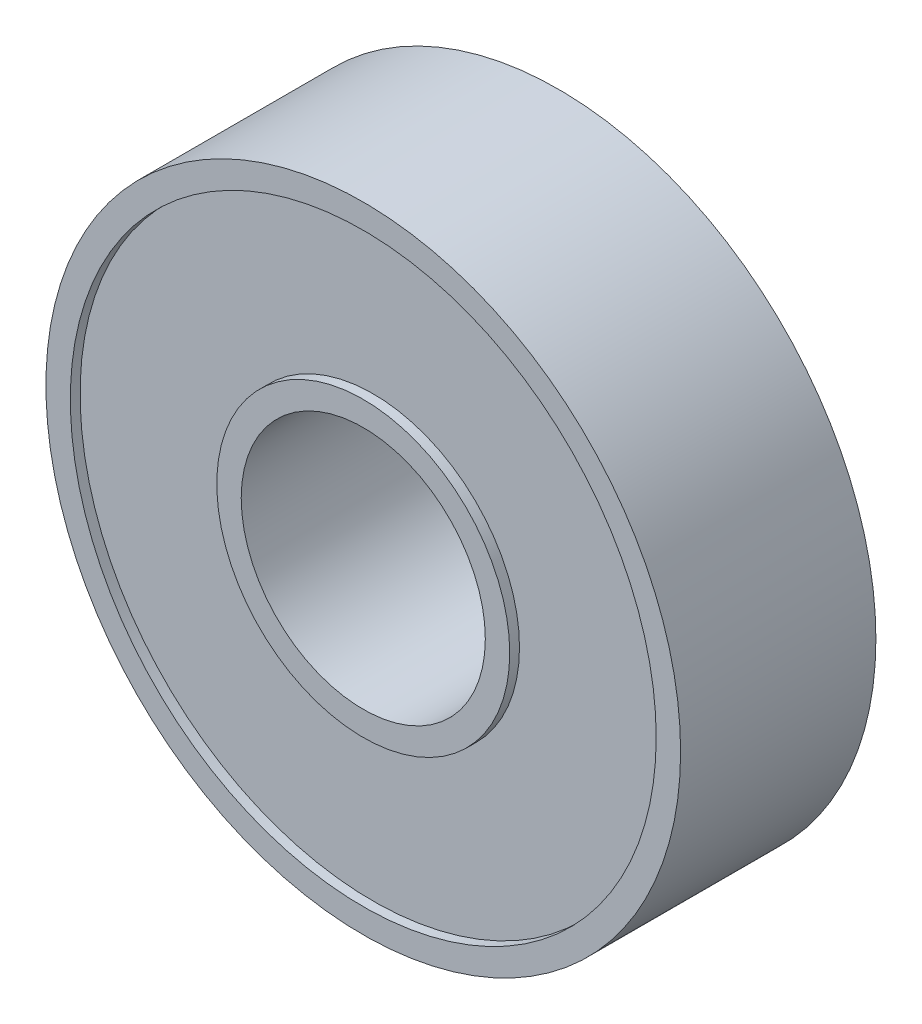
SolidWorks part; units mm, degrees
ref_plane "Спереди" through (0, 0, 0) normal (0, 0, 1) x (1, 0, 0)
ref_plane "Сверху" through (0, 0, 0) normal (0, 1, 0) x (1, 0, 0)
ref_plane "Справа" through (0, 0, 0) normal (1, 0, 0) x (0, 0, -1)
other "Configuration Table"
sketch "Эскиз1" plane through (0, 0, 0) normal (0, 0, 1) x (1, 0, 0)
  circle A0 centre (0, 0) radius 6.5
  circle A1 centre (0, 0) radius 2.5
  dimension "D1" = 13
  dimension "D2" = 5
extrude "Бобышка-Вытянуть1" add sketch "Эскиз1" along normal blind 4
sketch "Эскиз2" plane through (0, 0, 4) normal (0, 0, 1) x (1, 0, 0)
  circle A2 centre (0, 0) radius 6
  circle A3 centre (0, 0) radius 6
  circle A5 centre (0, 0) radius 3
  circle A6 centre (0, 0) radius 3
  dimension "D1" = 0.5
  dimension "D2" = 0.5
extrude "Вырез-Вытянуть1" cut sketch "Эскиз2" against normal blind 0.2
sketch "Эскиз3" plane through (0, 0, 0) normal (0, 0, -1) x (-1, 0, 0)
  circle A0 centre (0, 0) radius 3 construction
  circle A1 centre (0, 0) radius 6
  circle A2 centre (0, 0) radius 6
  circle A3 centre (0, 0) radius 3
  dimension "D1" = 0
extrude "Вырез-Вытянуть2" cut sketch "Эскиз3" against normal blind 0.2
